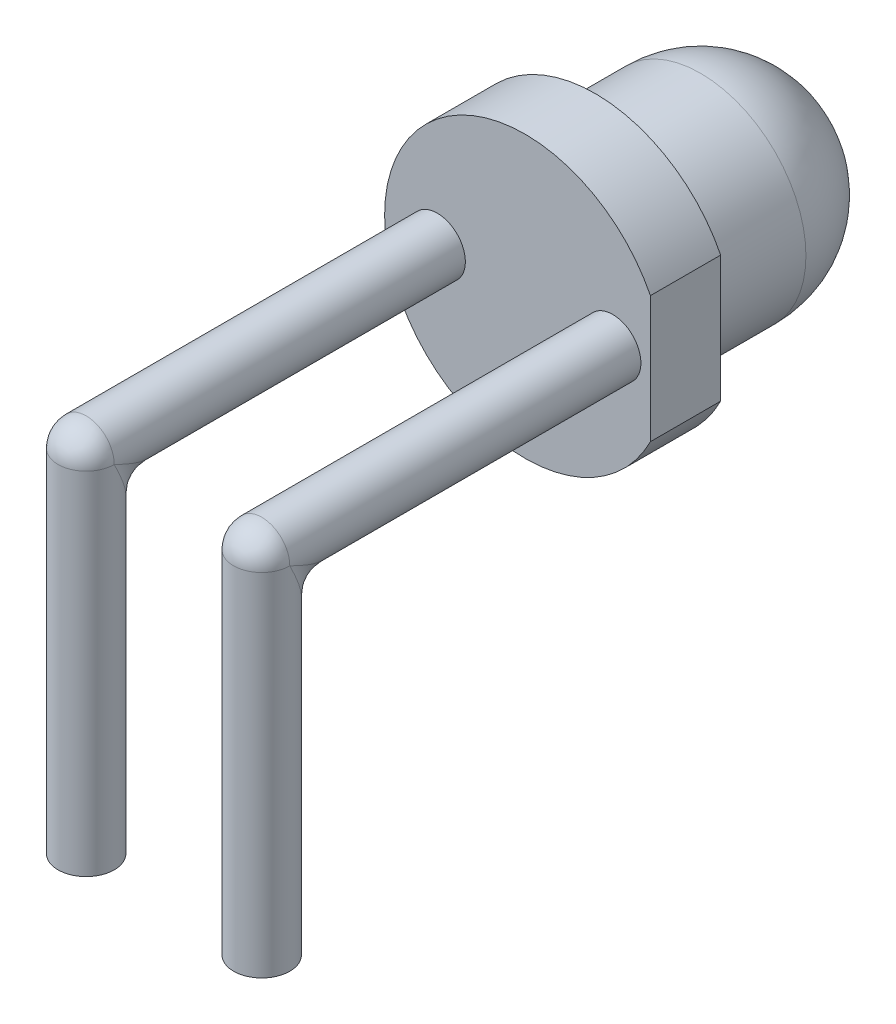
SolidWorks part; units mm, degrees
ref_plane "Face" through (0, 0, 0) normal (0, 0, 1) x (1, 0, 0)
ref_plane "Dessus" through (0, 0, 0) normal (0, 1, 0) x (1, 0, 0)
ref_plane "Droite" through (0, 0, 0) normal (1, 0, 0) x (0, 0, -1)
sketch "Esquisse1" plane through (0, 0, 0) normal (0, 0, 1) x (1, 0, 0)
  circle A0 centre (0, 0) radius 1.5
  dimension "D1" = 3
extrude "Base-Extrusion" add sketch "Esquisse1" along normal blind 4
sketch "Esquisse2" plane through (0, 0, 4) normal (0, 0, 1) x (1, 0, 0)
  line L0 (1.7857, -2.4917) -> (1.7857, 2.5621) construction
  line L1 (1.7857, 0.9007) -> (1.7857, -0.9007)
  arc A0 (1.7857, 0.9007) -> (1.7857, -0.9007) centre (0, 0) ccw
  dimension "D1" = 2
extrude "Boss.-Extru.1" add sketch "Esquisse2" against normal blind 1
fillet "Congé1" radius 1.5 1 edges at (1.5, 0, 0)
sketch "Esquisse3" plane through (0, 0, 4) normal (0, 0, 1) x (1, 0, 0)
  line L0 (0, 1.3283) -> (0, -0.9758) construction
  circle A0 centre (-1.25, 0) radius 0.4
  circle A1 centre (1.25, 0) radius 0.4
  dimension "D1" = 0.8
  dimension "D2" = 2.5
ref_plane "Plan2" through (0, 0, 0) normal (1, 0, 0) x (0, 0, -1)
sketch "Esquisse5" plane through (0, 0, 0) normal (1, 0, 0) x (0, 0, -1)
  line L0 (-4, 0) -> (-9, 0)
  line L1 (-9, 0) -> (-9, -5)
  line L2 (-4, 0.4) -> (-4, -0.4) construction
  dimension "D1" = 5
sweep "Balayage2" add profiles "Esquisse3" path "Esquisse5"
fillet "Congé2" radius 0.4 2 edges at (-1.25, -0.4, 8.6) (1.25, -0.4, 8.6)
